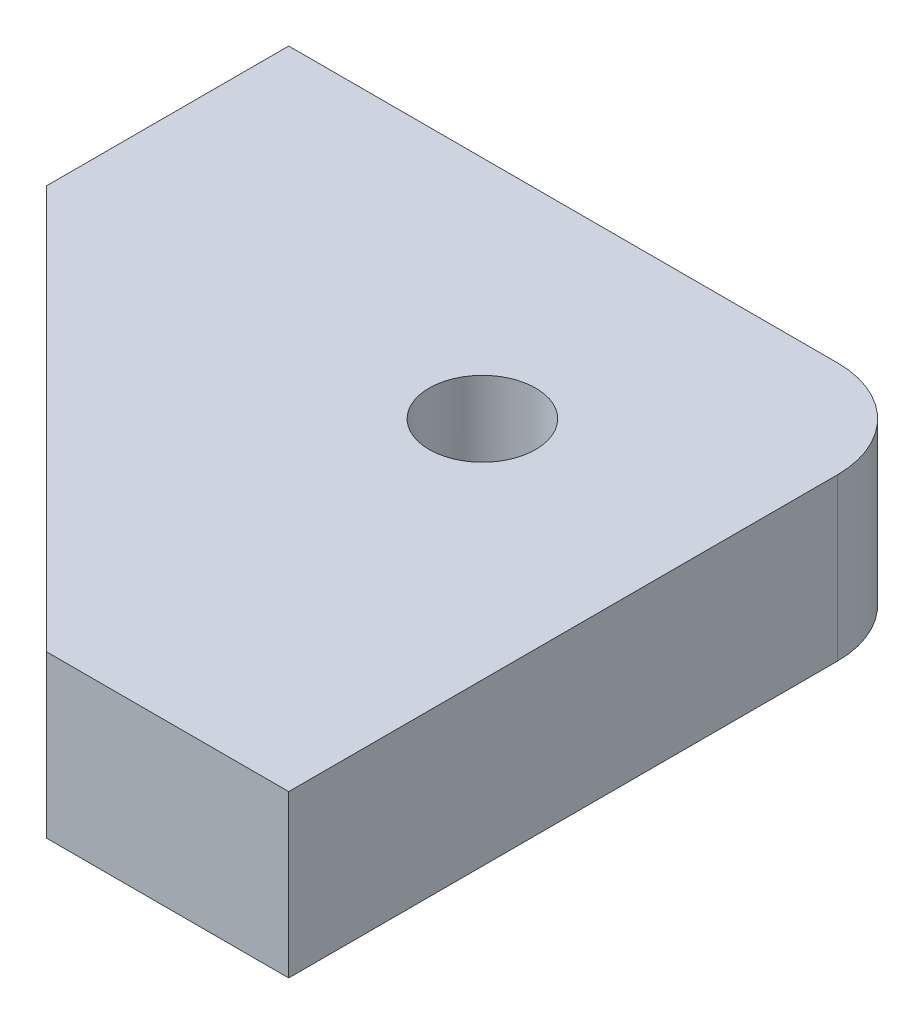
SolidWorks part; units mm, degrees
ref_plane "Front Plane" through (0, 0, 0) normal (0, 0, 1) x (1, 0, 0)
ref_plane "Top Plane" through (0, 0, 0) normal (0, 1, 0) x (1, 0, 0)
ref_plane "Right Plane" through (0, 0, 0) normal (1, 0, 0) x (0, 0, -1)
sketch "Sketch1" plane through (0, 0, 0) normal (0, 1, 0) x (1, 0, 0)
  line L0 (-124.8653, 0) -> (6118.4006, 0) construction
  line L1 (0, -124.8653) -> (0, 6118.4006) construction
  line L2 (4, 7) -> (-13, 7)
  line L3 (-13, 7) -> (-13, -0.5)
  line L4 (-13, -0.5) -> (-0.5, -13)
  line L5 (-0.5, -13) -> (7, -13)
  line L6 (7, -13) -> (7, 4)
  arc A1 (4, 7) -> (7, 4) centre (4, 4) cw
  dimension "D5" = 3
  dimension "D1" = 7
  dimension "D2" = 20
  dimension "D3" = 7
  dimension "D6" = 7.5
extrude "Boss-Extrude1" add sketch "Sketch1" along normal mid plane 5
hole_wizard "M4x0.7 Tapped Hole1" positions "Sketch4" profile "Sketch5" tap size "M4x0.7" standard "ANSI Metric"
sketch "Sketch4" plane through (0, 2.5, 0) normal (0, 1, 0) x (1, 0, 0)
  line L0 (4, 7) -> (-13, 7) construction
  line L1 (7, -13) -> (7, 4) construction
  point P4 (0, 0)
sketch "Sketch5" plane through (0, 2.5, 0) normal (1, 0, 0) x (0, 0, 1)
  line L0 (0, 0) -> (0, 11.0914)
  line L1 (0, 11.0914) -> (1.65, 10.1)
  line L2 (1.65, 10.1) -> (1.65, 0)
  line L5 (1.65, 0) -> (0, 0)
  line L10 (0, 11.0914) -> (-1.65, 10.1) construction
  line L11 (0, -6.35) -> (0, 107.95) construction
  dimension "Tap Drill Dia." = 3.3
  dimension "Tap Drill Depth" = 10.1
  dimension "Drill Angle" = 118
